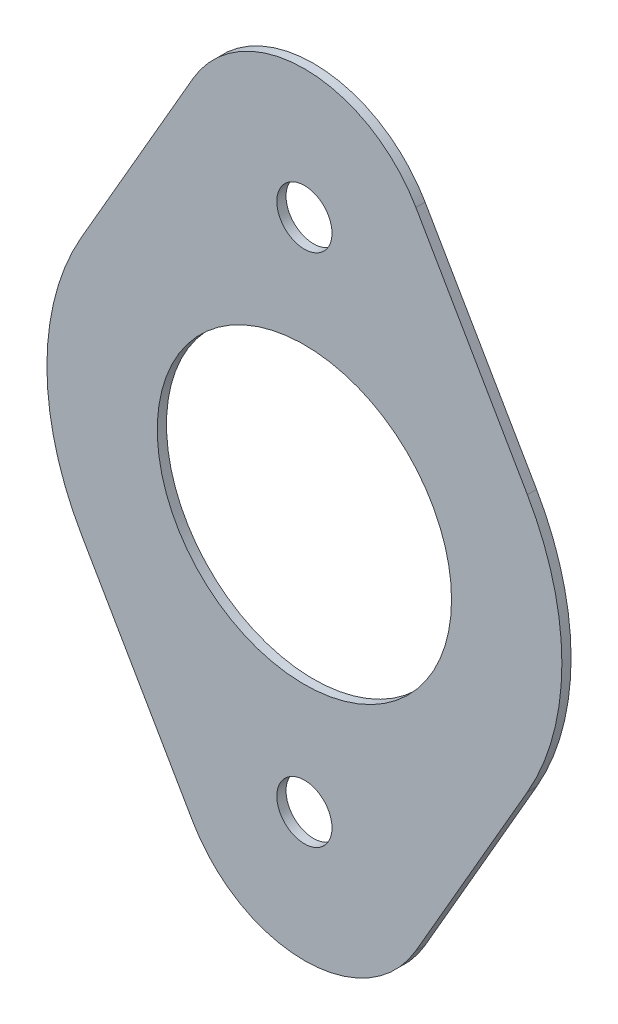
SolidWorks part; units mm, degrees
ref_plane "Front" through (0, 0, 0) normal (0, 0, 1) x (1, 0, 0)
ref_plane "Top" through (0, 0, 0) normal (0, 1, 0) x (1, 0, 0)
ref_plane "Right" through (0, 0, 0) normal (1, 0, 0) x (0, 0, -1)
sketch "Sketch1" plane through (0, 0, 0) normal (0, 0, 1) x (1, 0, 0)
  line L0 (0, 0) -> (0, 94.4945) construction
  line L1 (0, 0) -> (88.837, 0) construction
  line L2 (19.2474, 55.5625) -> (38.4948, 22.225)
  line L3 (19.2474, -55.5625) -> (38.4948, -22.225)
  line L4 (-19.2474, 55.5625) -> (-38.4948, 22.225)
  line L5 (-19.2474, -55.5625) -> (-38.4948, -22.225)
  arc A0 (-19.2474, 55.5625) -> (19.2474, 55.5625) centre (0, 44.45) cw
  arc A1 (-19.2474, -55.5625) -> (19.2474, -55.5625) centre (0, -44.45) ccw
  arc A2 (38.4948, 22.225) -> (38.4948, -22.225) centre (0, 0) cw
  arc A3 (-38.4948, -22.225) -> (-38.4948, 22.225) centre (0, 0) cw
  dimension "EndR" = 22.225
  dimension "SideR" = 44.45
  dimension "CtoC" = 88.9
extrude "Main" add sketch "Sketch1" along normal blind 1.5875
sketch "Sketch2" plane through (0, 0, 1.5875) normal (0, 0, 1) x (1, 0, 0)
  circle A0 centre (0, 44.45) radius 4.7625
  circle A1 centre (0, -44.45) radius 4.7625
  circle A2 centre (0, 0) radius 25.4
  dimension "BoltH" = 9.525
  dimension "CenterH" = 50.8
extrude "Holes" cut sketch "Sketch2" against normal through all
